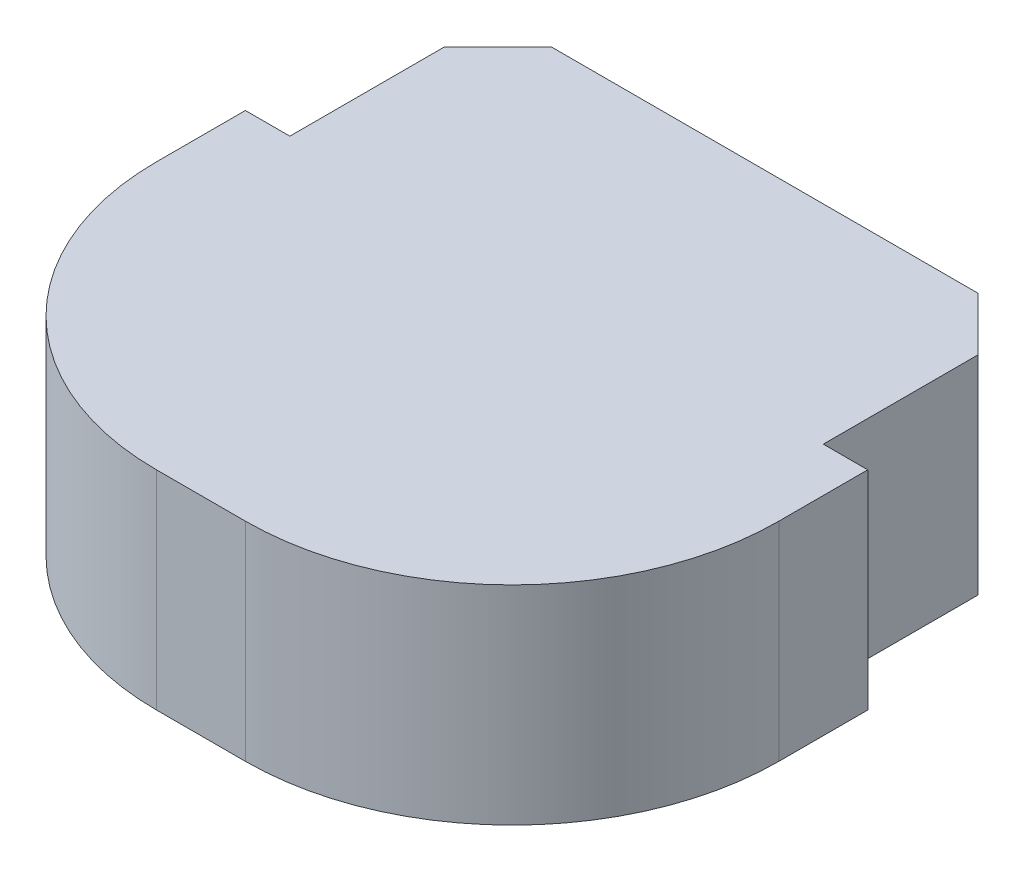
SolidWorks part; units mm, degrees
ref_plane "Front Plane" through (0, 0, 0) normal (0, 0, 1) x (1, 0, 0)
ref_plane "Top Plane" through (0, 0, 0) normal (0, 1, 0) x (1, 0, 0)
ref_plane "Right Plane" through (0, 0, 0) normal (1, 0, 0) x (0, 0, -1)
sketch "Sketch1" plane through (0, 0, 0) normal (0, 1, 0) x (1, 0, 0)
  line L1 (-4.445, 2.54) -> (4.445, 2.54)
  line L2 (-4.445, 2.54) -> (-4.445, -2.54)
  line L3 (-4.445, -2.54) -> (4.445, -2.54)
  line L4 (4.445, 2.54) -> (4.445, -2.54)
  line L5 (-4.445, 2.54) -> (4.445, -2.54) construction
  line L6 (-4.445, -2.54) -> (4.445, 2.54) construction
  point P0 (0, 0)
extrude "Boss-Extrude1" add sketch "Sketch1" along normal blind 2.9718
sketch "Sketch2" plane through (0, 0, -2.54) normal (0, 0, -1) x (-1, 0, 0)
  line L0 (0, 2.9718) -> (0, 0) construction
  line L1 (-4.445, 2.9718) -> (4.445, 2.9718) construction
  line L2 (-4.445, 0) -> (4.445, 0) construction
  line L3 (-3.81, 2.9718) -> (3.81, 2.9718)
  line L4 (-3.81, 2.9718) -> (-3.81, 0)
  line L5 (-3.81, 0) -> (3.81, 0)
  line L6 (3.81, 2.9718) -> (3.81, 0)
  line L7 (-3.81, 2.9718) -> (3.81, 0) construction
  line L8 (-3.81, 0) -> (3.81, 2.9718) construction
  point P5 (0, 1.4859)
  dimension "D1" = 7.62
extrude "Boss-Extrude2" add sketch "Sketch2" along normal blind 2.9718
chamfer "Chamfer1" distance 0.762 angle 45 2 edges at (-3.81, 1.4859, -5.5118) (3.81, 1.4859, -5.5118)
fillet "Fillet1" radius 3.81 2 edges at (-4.445, 1.4859, 2.54) (4.445, 1.4859, 2.54)
sketch "Sketch3" plane through (0, 2.9718, 0) normal (0, 1, 0) x (1, 0, 0)
  line L20 (-4.5466, 2.6416) -> (-4.5466, 1.27)
  line L21 (-0.635, -2.6416) -> (0.635, -2.6416)
  line L22 (4.5466, 1.27) -> (4.5466, 2.6416)
  line L23 (4.5466, 2.6416) -> (3.9116, 2.6416)
  line L24 (3.9116, 2.6416) -> (3.9116, 4.7919)
  line L25 (3.9116, 4.7919) -> (3.0901, 5.6134)
  line L26 (3.0901, 5.6134) -> (-3.0901, 5.6134)
  line L27 (-3.0901, 5.6134) -> (-3.9116, 4.7919)
  line L28 (-3.9116, 4.7919) -> (-3.9116, 2.6416)
  line L29 (-3.9116, 2.6416) -> (-4.5466, 2.6416)
  line L30 (-4.5466, 2.6416) -> (-4.5466, 1.27)
  line L31 (-0.635, -2.6416) -> (0.635, -2.6416)
  line L32 (4.5466, 1.27) -> (4.5466, 2.6416)
  line L33 (4.5466, 2.6416) -> (3.9116, 2.6416)
  line L34 (3.9116, 2.6416) -> (3.9116, 4.7919)
  line L35 (3.9116, 4.7919) -> (3.0901, 5.6134)
  line L36 (3.0901, 5.6134) -> (-3.0901, 5.6134)
  line L37 (-3.0901, 5.6134) -> (-3.9116, 4.7919)
  line L38 (-3.9116, 4.7919) -> (-3.9116, 2.6416)
  line L39 (-3.9116, 2.6416) -> (-4.5466, 2.6416)
  arc A4 (-4.5466, 1.27) -> (-0.635, -2.6416) centre (-0.635, 1.27) ccw
  arc A5 (0.635, -2.6416) -> (4.5466, 1.27) centre (0.635, 1.27) ccw
  arc A6 (-4.5466, 1.27) -> (-0.635, -2.6416) centre (-0.635, 1.27) ccw
  arc A7 (0.635, -2.6416) -> (4.5466, 1.27) centre (0.635, 1.27) ccw
equation "\"D2@Sketch1\"=.2"
equation "\"D1@Boss-Extrude1\"=\"t\""
equation "\"t\"= .117'plywood thickness"
equation "\"kerf\"= .004in'Kerf for laser cutter"
equation "\"D1@Boss-Extrude2\"=\"t\""
equation "\"D1@Sketch3\"=\"kerf\""
